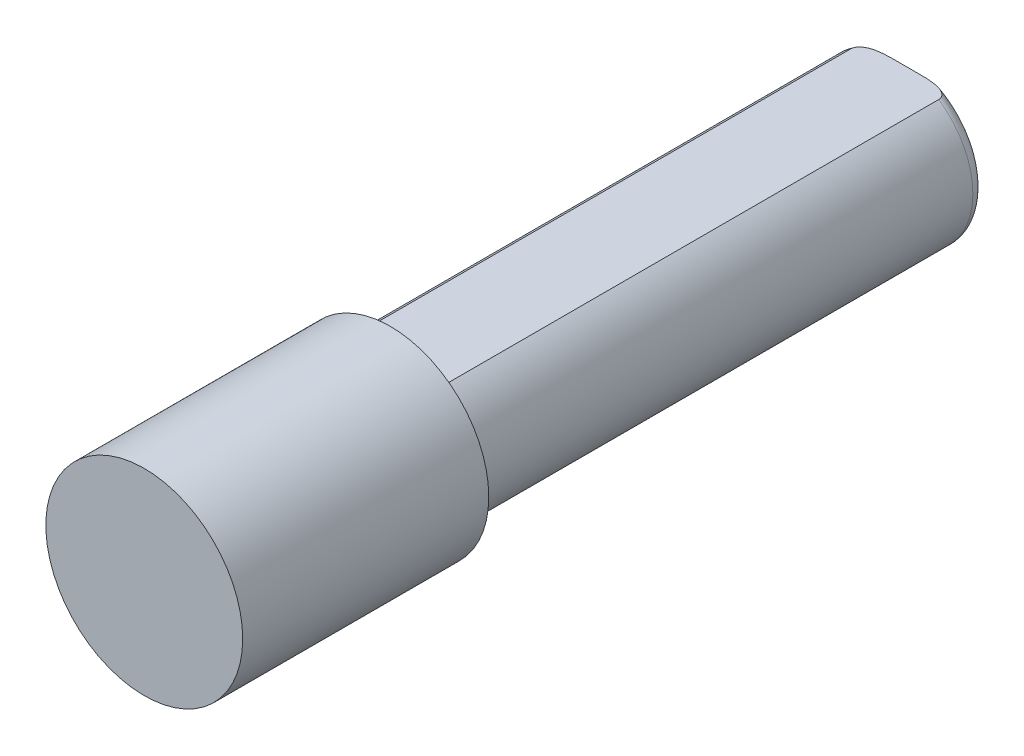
SolidWorks part; units mm, degrees
ref_plane "前视" through (0, 0, 0) normal (0, 0, 1) x (1, 0, 0)
ref_plane "上视" through (0, 0, 0) normal (0, 1, 0) x (1, 0, 0)
ref_plane "右视" through (0, 0, 0) normal (1, 0, 0) x (0, 0, -1)
sketch "草图1" plane through (0, 0, 0) normal (0, 0, 1) x (1, 0, 0)
  circle A0 centre (0, 0) radius 3.175
extrude "凸台-拉伸1" add sketch "草图1" along normal blind 21
sketch "草图2" plane through (0, 0, 21) normal (0, 0, 1) x (1, 0, 0)
  circle A0 centre (0, 0) radius 4
extrude "凸台-拉伸2" add sketch "草图2" along normal blind 10
sketch "草图3" plane through (0, 0, 0) normal (0, 0, -1) x (-1, 0, 0)
  line L0 (-1.7861, 2.625) -> (1.7861, 2.625)
  arc A0 (1.7861, 2.625) -> (-1.7861, 2.625) centre (0, 0) ccw
extrude "切除-拉伸1" cut sketch "草图3" against normal blind 21
fillet "圆角1" radius 0.5 1 edges at (0, -3.175, 0)
